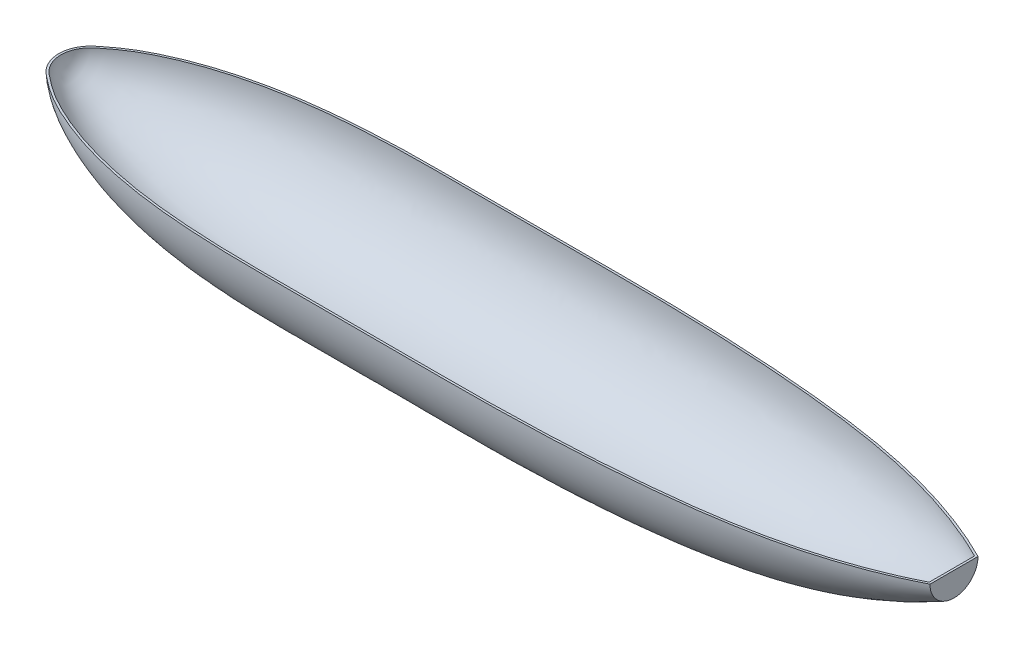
SolidWorks part; units mm, degrees
ref_plane "Plane1" through (0, 0, 0) normal (0, 0, 1) x (1, 0, 0)
ref_plane "Plane2" through (0, 0, 0) normal (0, 1, 0) x (1, 0, 0)
ref_plane "Plane3" through (0, 0, 0) normal (1, 0, 0) x (0, 0, -1)
sketch "Shell Outline" plane through (0, 0, 0) normal (0, 0, 1) x (1, 0, 0)
  line L0 (1168.4, 0) -> (-1492.25, 0) construction
  line L2 (0, 0) -> (0, -260.35) construction
  line L3 (1168.4, -67.818) -> (1168.4, 0)
  line L4 (-1492.25, 0) -> (-1492.25, -0.7938)
  spline S0 degree 3 poles (-1492.25, -0.7938) (-1492.2158, -2.1449) (-1492.1508, -4.7162) (-1491.8134, -8.7517) (-1491.2751, -12.9255) (-1490.4068, -17.6656) (-1489.1978, -22.644) (-1487.6181, -27.7631) (-1485.7, -32.8827) (-1483.2506, -38.3646) (-1480.2203, -44.0193) (-1476.7949, -49.3799) (-1467.4657, -61.9169) (-1440.705, -83.8406) (-1399.0434, -114.1771) (-1347.1468, -141.7756) (-1296.0236, -164.4085) (-1245.0685, -183.4858) (-1177.6003, -204.6617) (-1092.9261, -224.8365) (-991.0267, -241.8483) (-889.1768, -252.1601) (-770.5695, -259.1683) (-682.3369, -260.3701) (-622.1532, -260.3485) (-606.6148, -260.3505) (-590.1835, -260.3499) (-574.2649, -260.35) (-559.631, -260.35) (-542.3011, -260.35) (-525.4861, -260.35) (-508.5431, -260.35) (-494.9379, -260.35) (-481.7166, -260.35) (-468.2387, -260.35) (-454.7606, -260.35) (-441.5398, -260.35) (-428.5753, -260.35) (-415.2266, -260.35) (-401.2355, -260.35) (-389.4282, -260.35) (-378.5157, -260.35) (-369.7869, -260.35) (-360.0318, -260.35) (-350.6615, -260.35) (-341.0371, -260.35) (-330.898, -260.35) (-321.3997, -260.3502) (-210.6286, -260.3425) (-53.4082, -261.6831) (152.4542, -258.1833) (304.9048, -251.8174) (440.4246, -242.867) (558.943, -231.2667) (660.7144, -218.9242) (762.46, -201.879) (864.3734, -180.001) (966.3591, -151.3553) (1050.6903, -120.908) (1118.1816, -92.5478) (1151.5457, -76.1178) (1168.4, -67.818) knots 0 0 0 0 0.001464 0.002786 0.004386 0.006022 0.008005 0.009933 0.011823 0.013926 0.016434 0.018767 0.020814 0.033341 0.055843 0.076738 0.09682 0.116415 0.135651 0.173409 0.210615 0.247511 0.284272 0.339323 0.343084 0.349481 0.356159 0.360887 0.366729 0.372015 0.379664 0.384948 0.390372 0.394405 0.399273 0.404976 0.409009 0.413598 0.419023 0.423472 0.428758 0.431816 0.435296 0.438215 0.442386 0.445449 0.448643 0.453371 0.45574 0.568664 0.623715 0.678805 0.733975 0.770844 0.807824 0.84503 0.882582 0.920713 0.959713 0.979649 1 1 1 1
  point P3 (-635, -260.35)
  point P4 (-787.4, -257.556)
  point P5 (-1397, -113.792)
  point P6 (-889, -251.46)
  point P7 (-990.6, -240.792)
  point P8 (-1092.2, -223.774)
  point P9 (-1447.8, -77.724)
  point P10 (-1193.8, -199.136)
  point P11 (-1244.6, -183.134)
  point P12 (-1295.4, -164.084)
  point P13 (-1346.2, -141.478)
  point P14 (-1473.2, -54.102)
  point P15 (152.4, -257.556)
  point P16 (304.8, -251.206)
  point P17 (863.6, -179.07)
  point P18 (965.2, -150.368)
  point P19 (457.2, -240.792)
  point P20 (558.8, -230.886)
  point P21 (660.4, -218.186)
  point P23 (762, -201.168)
  point P24 (1066.8, -113.792)
  point P25 (1117.6, -92.202)
  point P26 (1168.4, -67.818)
  point P52 (-1492.1063, -4.845)
  point P53 (-1491.8101, -8.4942)
  point P55 (-1491.2413, -12.8856)
  point P56 (-1490.4264, -17.3425)
  point P57 (-1489.131, -22.679)
  point P58 (-1487.5577, -27.7786)
  point P61 (-1485.7215, -32.6801)
  point P62 (-1483.3463, -37.9947)
  point P63 (-1480.0644, -44.1155)
  point P64 (-1476.5851, -49.5566)
  dimension "D25" = 857.25
  dimension "D2" = 260.35
  dimension "D3" = 152.4
  dimension "D4" = 257.556
  dimension "D5" = 251.46
  dimension "D6" = 254
  dimension "D7" = 355.6
  dimension "D8" = 240.792
  dimension "D9" = 223.774
  dimension "D10" = 457.2
  dimension "D11" = 558.8
  dimension "D12" = 199.136
  dimension "D13" = 609.6
  dimension "D14" = 183.134
  dimension "D15" = 660.4
  dimension "D16" = 164.084
  dimension "D17" = 711.2
  dimension "D18" = 141.478
  dimension "D19" = 762
  dimension "D20" = 113.792
  dimension "D21" = 812.8
  dimension "D22" = 77.724
  dimension "D23" = 838.2
  dimension "D24" = 54.102
  dimension "D26" = 1168.4
  dimension "D27" = 0.7937
  dimension "D28" = 152.4
  dimension "D29" = 257.556
  dimension "D30" = 304.8
  dimension "D31" = 251.206
  dimension "D32" = 457.2
  dimension "D33" = 240.792
  dimension "D34" = 558.8
  dimension "D35" = 230.886
  dimension "D36" = 660.4
  dimension "D37" = 218.186
  dimension "D38" = 762
  dimension "D39" = 201.168
  dimension "D40" = 179.07
  dimension "D41" = 863.6
  dimension "D42" = 150.368
  dimension "D43" = 965.2
  dimension "D44" = 113.792
  dimension "D45" = 1066.8
  dimension "D46" = 92.202
  dimension "D47" = 1117.6
  dimension "D48" = 67.818
  dimension "D49" = 635
  dimension "D50" = 841.5851
  dimension "D51" = 845.0644
  dimension "D52" = 848.3463
  dimension "D53" = 850.7215
  dimension "D54" = 852.5577
  dimension "D55" = 854.131
  dimension "D56" = 855.4264
  dimension "D57" = 856.2413
  dimension "D58" = 856.8101
  dimension "D59" = 857.1063
  dimension "D60" = 49.5566
  dimension "D61" = 44.1155
  dimension "D62" = 37.9947
  dimension "D63" = 32.6801
  dimension "D64" = 27.7786
  dimension "D65" = 22.679
  dimension "D66" = 17.3425
  dimension "D67" = 12.8856
  dimension "D68" = 8.4942
  dimension "D69" = 9.69
revolve "Form Shell" add sketch "Shell Outline" angle 180 mid plane about L0
